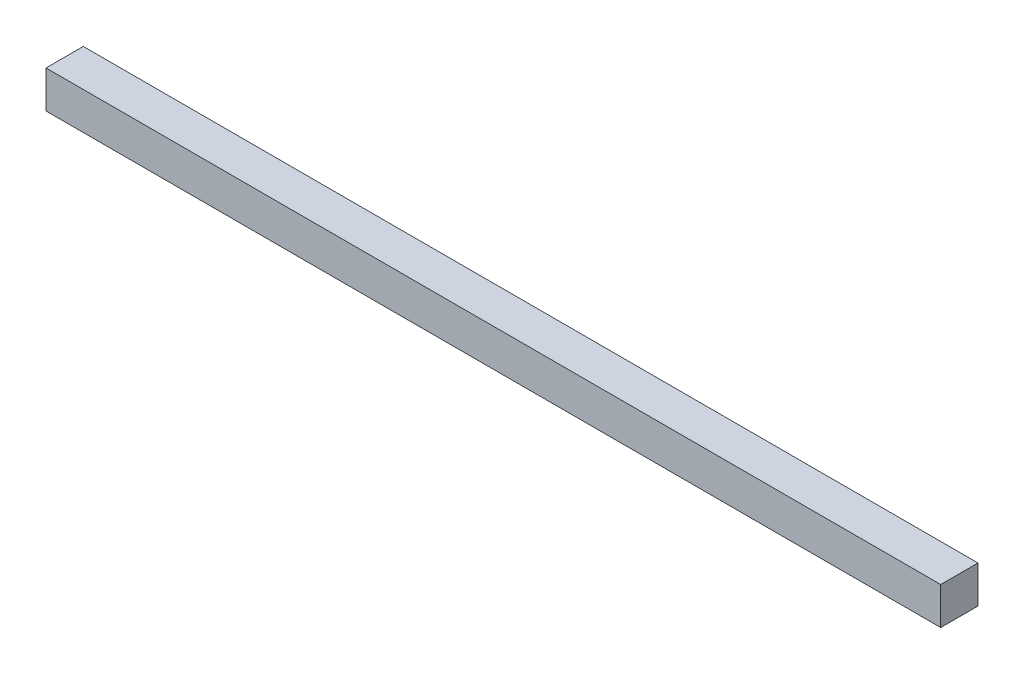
SolidWorks part; units mm, degrees
ref_plane "Front Plane" through (0, 0, 0) normal (0, 0, 1) x (1, 0, 0)
ref_plane "Top Plane" through (0, 0, 0) normal (0, 1, 0) x (1, 0, 0)
ref_plane "Right Plane" through (0, 0, 0) normal (1, 0, 0) x (0, 0, -1)
sketch "Sketch1" plane through (0, 0, 0) normal (1, 0, 0) x (0, 0, -1)
  line L0 (0, 0) -> (-3.175, 0)
  line L1 (-3.175, 0) -> (-3.175, 3.175)
  line L2 (0, 0) -> (0, 3.175)
  line L3 (0, 3.175) -> (-3.175, 3.175)
extrude "Boss-Extrude1" add sketch "Sketch1" along normal blind 76.2
